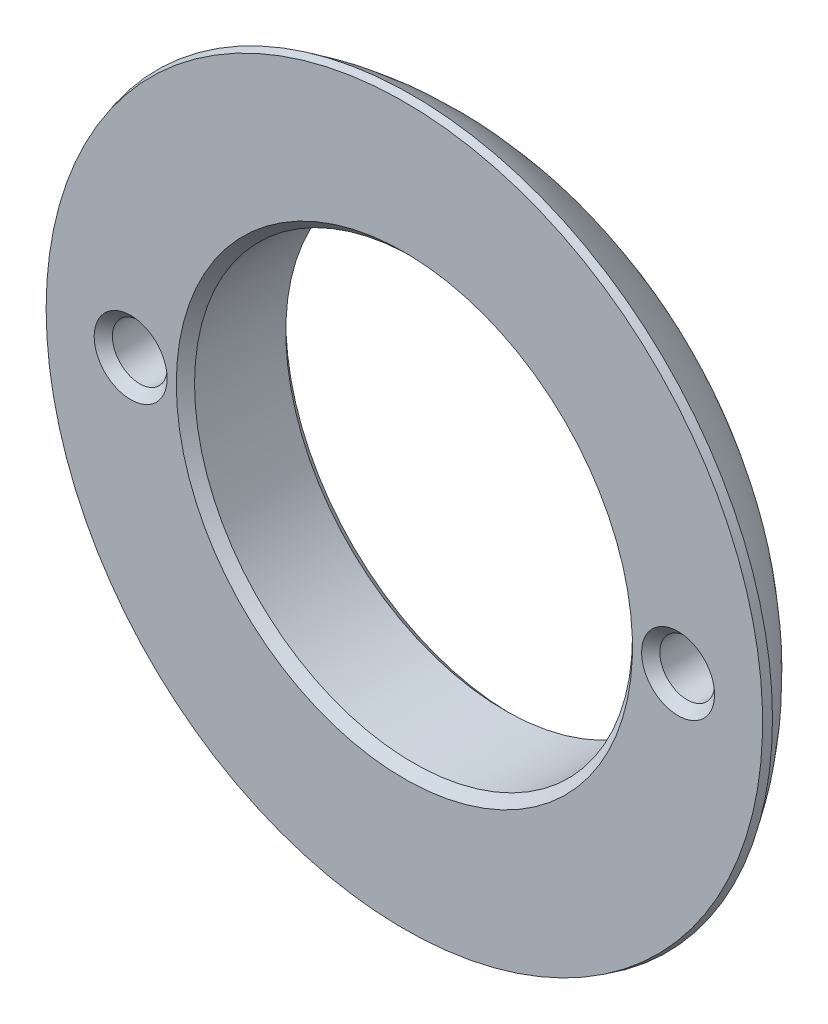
SolidWorks part; units mm, degrees
ref_plane "Спереди" through (0, 0, 0) normal (0, 0, 1) x (1, 0, 0)
ref_plane "Сверху" through (0, 0, 0) normal (0, 1, 0) x (1, 0, 0)
ref_plane "Справа" through (0, 0, 0) normal (1, 0, 0) x (0, 0, -1)
sketch "Эскиз1" plane through (0, 0, 0) normal (1, 0, 0) x (0, 0, -1)
  line L0 (1.5, 6) -> (-1.5, 6)
  line L1 (-1.5, 6) -> (-1.5, 10)
  line L2 (-1.5, 0) -> (1.5, 0) construction
  line L3 (1.5, 6) -> (1.5, 6.4671)
  arc A0 (1.5, 6.4671) -> (-1.5, 10) centre (-4.8, 4.1576) ccw
  dimension "D4" = 3.3
  dimension "D5" = 13.42
  dimension "D1" = 20
  dimension "D2" = 12
  dimension "D3" = 3
revolve "Повернуть1" add sketch "Эскиз1" angle 360 about L2
sketch "Эскиз2" plane through (0, 0, 1.5) normal (0, 0, 1) x (1, 0, 0)
  line L0 (-7.5, 0) -> (0, 0) construction
  line L1 (0, 0) -> (7.5, 0) construction
  circle A0 centre (-7.5, 0) radius 0.75
  circle A1 centre (7.5, 0) radius 0.75
  dimension "D1" = 1.5
  dimension "D2" = 15
extrude "Вырез-Вытянуть1" cut sketch "Эскиз2" against normal blind 1.5
chamfer "Фаска1" distance 0.25 angle 45 7 edges at (6, 0, 1.5) (6, 0, -1.5) (10, 0, 1.5) (8.25, 0, 1.5) (8.25, 0, 0) (-6.75, 0, 1.5) (-6.75, 0, 0)
